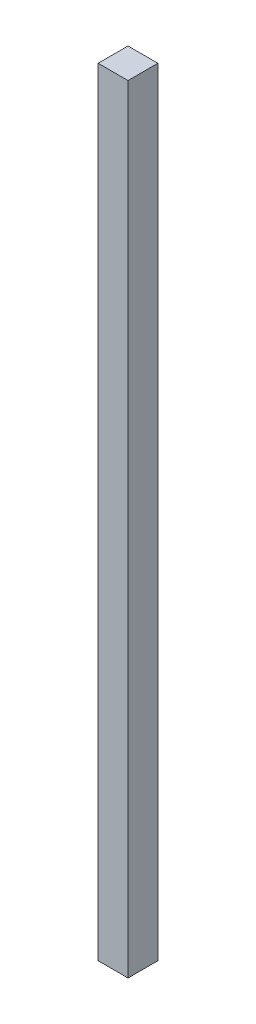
SolidWorks part; units mm, degrees
ref_plane "Alzado" through (0, 0, 0) normal (0, 0, 1) x (1, 0, 0)
ref_plane "Planta" through (0, 0, 0) normal (0, 1, 0) x (1, 0, 0)
ref_plane "Vista lateral" through (0, 0, 0) normal (1, 0, 0) x (0, 0, -1)
sketch "Croquis1" plane through (0, 0, 0) normal (0, 0, 1) x (1, 0, 0)
  line L1 (0, 0) -> (12, 0)
  line L2 (0, 0) -> (0, 312)
  line L3 (0, 312) -> (12, 312)
  line L4 (12, 0) -> (12, 312)
extrude "Saliente-Extruir1" add sketch "Croquis1" along normal blind 12
equation "\"material\" = 1.2"
equation "\"D2@Croquis1\"=\"material\""
equation "\"altura_cajones\"= 30"
equation "\"D1@Croquis1\"=\"altura_cajones\"+\"material\""
equation "\"D1@Saliente-Extruir1\"=\"material\""
